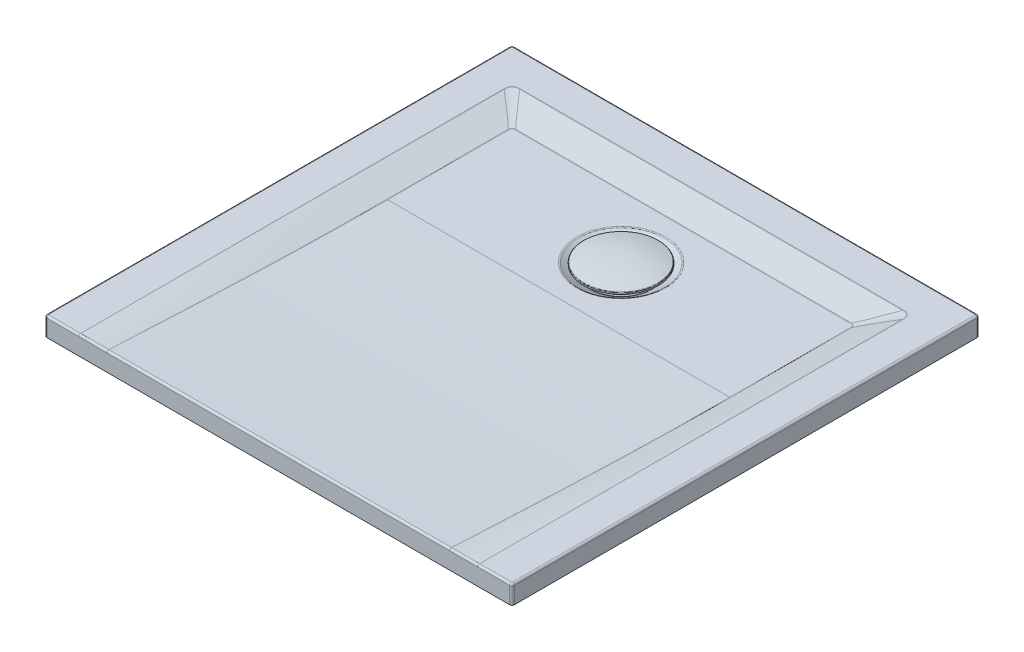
SolidWorks part; units mm, degrees
ref_plane "Płaszczyzna przednia" through (0, 0, 0) normal (0, 0, 1) x (1, 0, 0)
ref_plane "Płaszczyzna górna" through (0, 0, 0) normal (0, 1, 0) x (1, 0, 0)
ref_plane "Płaszczyzna prawa" through (0, 0, 0) normal (1, 0, 0) x (0, 0, -1)
sketch "Szkic1" plane through (0, 0, 0) normal (0, 1, 0) x (1, 0, 0)
  line L0 (0, 375) -> (0, -375) construction
  line L1 (-375, 375) -> (375, 375)
  line L2 (-375, 375) -> (-375, -375)
  line L3 (-375, -375) -> (375, -375)
  line L4 (375, 375) -> (375, -375)
  line L5 (-320, -375) -> (-320, 320)
  line L6 (-320, 320) -> (320, 320)
  line L7 (320, 320) -> (320, -375)
  line L8 (-275, -375) -> (-275, 275)
  line L9 (-275, 275) -> (275, 275)
  line L10 (275, 275) -> (275, -375)
  circle A0 centre (0, 175) radius 45
  circle A1 centre (0, 175) radius 70
  point P9 (0, 320)
  dimension "D6" = 90
  dimension "D7" = 140
  dimension "D1" = 750
  dimension "D2" = 55
  dimension "D3" = 55
  dimension "D5" = 200
  dimension "D8" = 750
  dimension "D4" = 45
sketch "Szkic2" plane through (0, 0, 0) normal (0, 1, 0) x (1, 0, 0)
  line L0 (-375, -375) -> (375, -375) construction
  line L1 (375, 375) -> (375, -375) construction
  line L2 (320, 320) -> (320, -375) construction
  line L3 (-320, 320) -> (320, 320) construction
  line L4 (-375, 375) -> (375, 375) construction
  line L5 (-320, -375) -> (-320, 320) construction
  line L6 (-375, 375) -> (-375, -375) construction
  line L7 (-375, -375) -> (-320, -375)
  line L8 (375, 375) -> (375, -375)
  line L9 (320, 320) -> (320, -375)
  line L10 (-320, 320) -> (320, 320)
  line L11 (-375, 375) -> (375, 375)
  line L12 (-320, -375) -> (-320, 320)
  line L13 (-375, 375) -> (-375, -375)
  line L14 (320, -375) -> (375, -375)
surface "Powierzchnia-Płaszczyzna1" sketch "Szkic2"
ref_plane "Płaszczyzna1" through (0, -15, 0) normal (0, 1, 0) x (-1, 0, 0)
sketch "Szkic3" plane through (0, -15, 0) normal (0, 1, 0) x (-1, 0, 0)
  line L0 (275, -75) -> (-275, -75)
  line L1 (275, 375) -> (275, -275) construction
  line L2 (-275, -275) -> (-275, 375) construction
  line L3 (0, -75) -> (0, -275) construction
  line L4 (275, -275) -> (-275, -275) construction
  line L5 (-275, -275) -> (-275, -75)
  line L6 (275, -75) -> (275, -275)
  line L7 (275, -275) -> (-275, -275)
  circle A0 centre (0, -175) radius 70 construction
  circle A1 centre (0, -175) radius 70
  point P10 (0, -175)
surface "Powierzchnia-Płaszczyzna2" sketch "Szkic3"
sketch "Szkic4" plane through (0, 0, 0) normal (0, 1, 0) x (1, 0, 0)
  line L0 (275, -375) -> (-275, -375)
other "Granica-Powierzchnia1"
other "Granica-Powierzchnia2"
other "Granica-Powierzchnia3"
mirror "Lustro1" about plane through (0, 0, 0) normal (1, 0, 0)
sketch "Szkic5" plane through (0, 0, 0) normal (0, 1, 0) x (1, 0, 0)
  line L0 (375, 375) -> (375, -375) construction
  line L1 (-375, 375) -> (375, 375) construction
  line L2 (-375, 375) -> (-375, -375) construction
  line L3 (-375, -375) -> (375, -375) construction
  line L4 (375, 375) -> (375, -375)
  line L5 (-375, 375) -> (375, 375)
  line L6 (-375, 375) -> (-375, -375)
  line L7 (-375, -375) -> (375, -375)
surface "Powierzchnia-Wyciągnięcie1" sketch "Szkic5" parameters "D1"=30
sketch "Szkic7" plane through (0, 0, 0) normal (1, 0, 0) x (0, 0, -1)
  line L0 (175, 0) -> (175, -30) construction
  line L1 (375, -30) -> (-375, -30) construction
  line L2 (220, -30) -> (220, -28)
  line L3 (220, -28) -> (224, -28)
  line L6 (224, -28) -> (245, -15)
  dimension "D1" = 90
  dimension "D2" = 2
  dimension "D3" = 98
surface "Powierzchnia-Obrót wokół linii środkowej1" sketch "Szkic7" parameters "D1"=360
surface "Powierzchnia-Płaszczyzna3"
surface "Powierzchnia-Połącz1"
fillet "Zaokrąglenie1" radius 4 6 edges at (0, -28, -224) (0, -15, -105) (375, -15, 375) (375, -15, -375) (-375, -15, -375) (-375, -15, 375)
fillet "Zmienne zaokrąglenie1" radius 40 2 edges at (297.5, -7.5, -297.5)
fillet "Zaokrąglenie3" radius 3 12 edges
fillet "Zaokrąglenie4" radius 3 12 edges at (-373.8284, 0, -373.8284) (0, 0, -375) (373.8284, 0, -373.8284) (375, 0, 0) (373.8284, 0, 373.8284) (345.5, 0, 375) (-345.5, 0, 375) (-373.8284, 0, 373.8284) (-375, 0, 0)
sketch "Szkic8" plane through (0, 0, 0) normal (1, 0, 0) x (0, 0, -1)
  line L0 (175, 0) -> (175, -30) construction
  line L1 (175, -5.6601) -> (179.8469, -5.6601) construction
  line L2 (235, -14.7573) -> (235, -17)
  line L3 (235, -17) -> (175, -17)
  line L4 (175, -17) -> (175, -5.6601)
  line L5 (175, -5.6601) -> (199.9922, 95.6514)
  arc A0 (175, -5.6601) -> (234.2694, -13.7943) centre (175, -225.6601) cw
  arc A1 (234.2694, -13.7943) -> (235, -14.7573) centre (234, -14.7573) cw
  point P11 (235, -14)
  dimension "D1" = 220
  dimension "D4" = 1
  dimension "D2" = 60
  dimension "D3" = 3
  dimension "D5" = 13
revolve "Obrót wokół linii środkowej1" add sketch "Szkic8" angle 360 about L4
